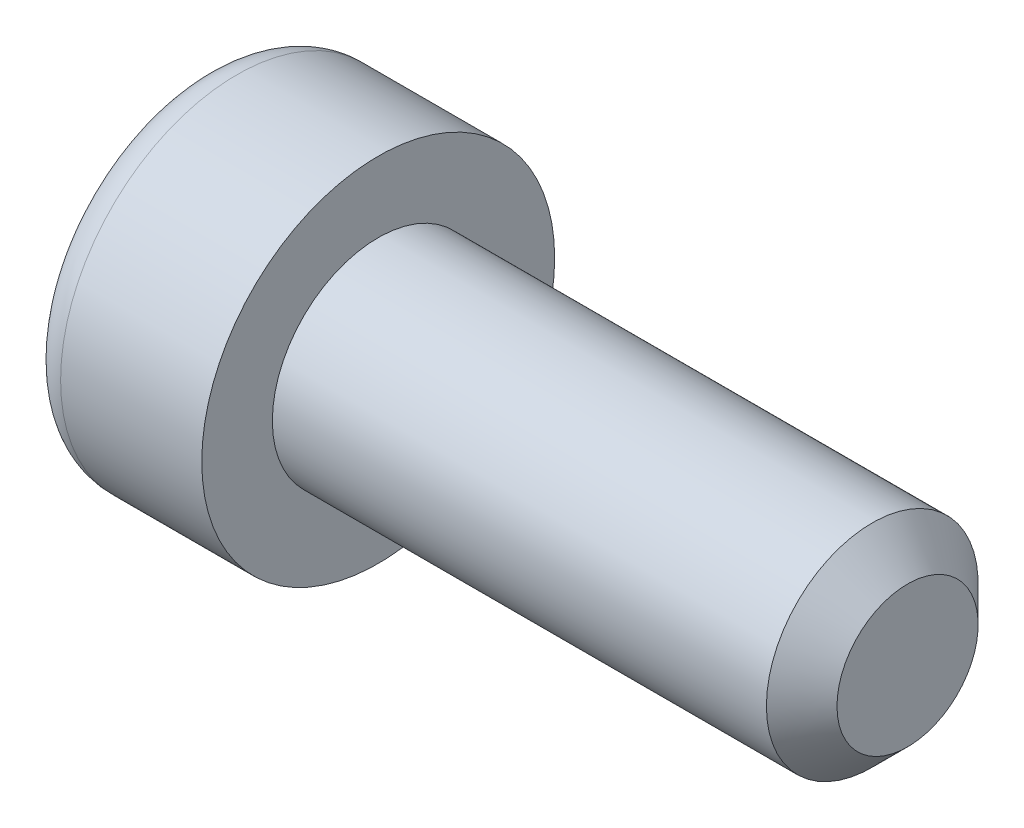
SolidWorks part; units mm, degrees
ref_plane "Plan de face" through (0, 0, 0) normal (0, 0, 1) x (1, 0, 0)
ref_plane "Plan de dessus" through (0, 0, 0) normal (0, 1, 0) x (1, 0, 0)
ref_plane "Plan de droite" through (0, 0, 0) normal (1, 0, 0) x (0, 0, -1)
sketch "Esquisse1" plane through (0, 0, 0) normal (0, 0, 1) x (1, 0, 0)
  line L0 (-45.6086, 0) -> (54.7574, 0) construction
  line L1 (41.3055, 0) -> (41.3055, 2)
  line L2 (40.3055, 3) -> (26.3055, 3)
  line L3 (26.3055, 3) -> (26.3055, 5)
  line L4 (26.3055, 5) -> (22.3055, 5)
  line L5 (21.3055, 4) -> (21.3055, 0)
  line L6 (40.3055, 3) -> (41.3055, 2)
  line L7 (41.3055, 0) -> (21.3055, 0)
  arc A0 (22.3055, 5) -> (21.3055, 4) centre (22.3055, 4) ccw
  point P12 (21.3055, 5)
  dimension "D3" = 1
  dimension "D1" = 3
  dimension "D2" = 5
  dimension "D4" = 5
  dimension "D5" = 1
  dimension "D6" = 1
revolve "Révolution1" add sketch "Esquisse1" angle 360 about L0
sketch "Esquisse2" plane through (21.3055, 0, 0) normal (-1, 0, 0) x (0, 0, 1)
  line L1 (0, 2.2358) -> (-1.9362, 1.1179)
  line L2 (-1.9362, 1.1179) -> (-1.9362, -1.1179)
  line L3 (-1.9362, -1.1179) -> (0, -2.2358)
  line L4 (0, -2.2358) -> (1.9362, -1.1179)
  line L5 (1.9362, -1.1179) -> (1.9362, 1.1179)
  line L6 (1.9362, 1.1179) -> (0, 2.2358)
  circle A0 centre (0, 0) radius 1.9362 construction
extrude "Enlèv. mat.-Extru.1" cut sketch "Esquisse2" against normal blind 3
